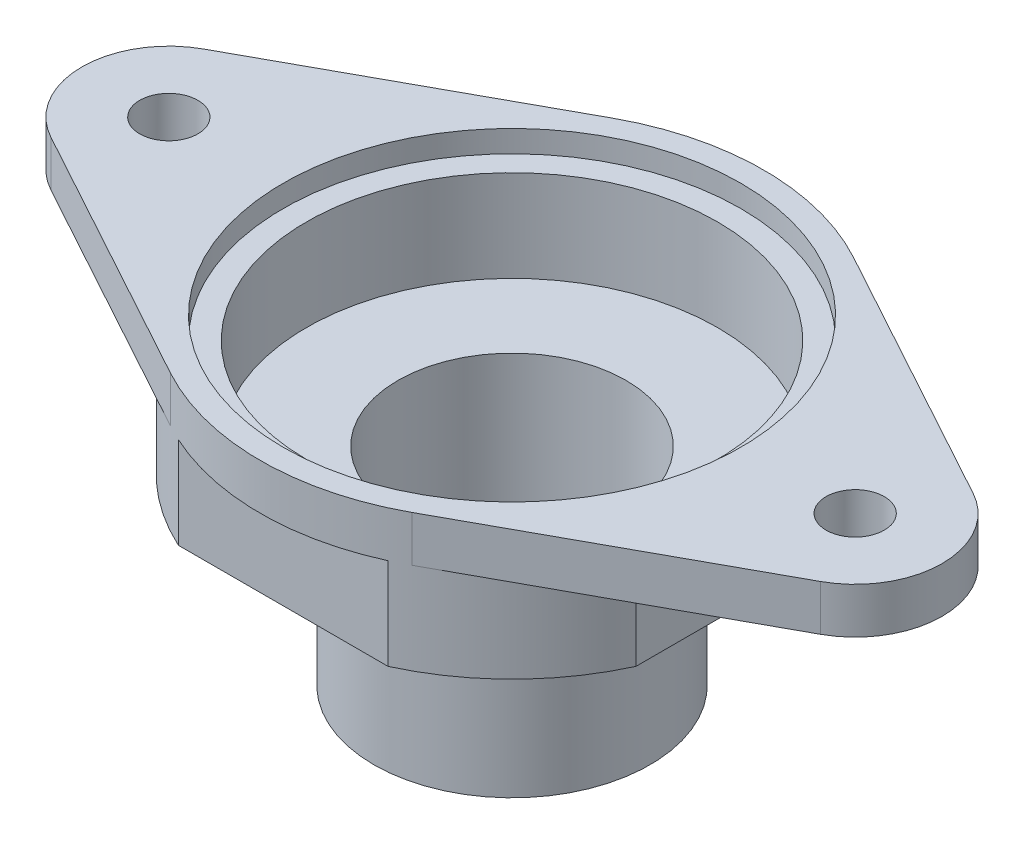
SolidWorks part; units mm, degrees
ref_plane "Front Plane" through (0, 0, 0) normal (0, 0, 1) x (1, 0, 0)
ref_plane "Top Plane" through (0, 0, 0) normal (0, 1, 0) x (1, 0, 0)
ref_plane "Right Plane" through (0, 0, 0) normal (1, 0, 0) x (0, 0, -1)
sketch "Sketch1" plane through (0, 0, 0) normal (0, 1, 0) x (1, 0, 0)
  line L1 (0, 0) -> (63.5, 0)
  line L2 (0, 0) -> (0, 50.8)
  line L3 (0, 50.8) -> (63.5, 50.8)
  line L4 (63.5, 0) -> (63.5, 50.8)
  dimension "D1" = 63.5
  dimension "D2" = 50.8
extrude "Boss-Extrude1" add sketch "Sketch1" along normal blind 22.225
sketch "Sketch2" plane through (0, 22.225, 0) normal (0, 1, 0) x (1, 0, 0)
  line L0 (31.75, 50.8) -> (31.75, 0) construction
  line L1 (63.5, 50.8) -> (0, 50.8) construction
  line L2 (0, 0) -> (63.5, 0) construction
  circle A0 centre (31.75, 25.4) radius 14.2684
  dimension "D1" = 28.5369
extrude "Cut-Extrude1" cut sketch "Sketch2" against normal blind 7.874
sketch "Sketch5" plane through (0, 22.225, 0) normal (0, 1, 0) x (1, 0, 0)
  circle A0 centre (31.75, 25.4) radius 15.875
  dimension "D1" = 31.75
extrude "Cut-Extrude3" cut sketch "Sketch5" against normal blind 1.524
hole_wizard "#10-32 Tapped Hole1" positions "Sketch8" profile "Sketch7" tap size "#10-32" standard "ANSI Inch"
sketch "Sketch8" plane through (0, 22.225, 0) normal (0, 1, 0) x (1, 0, 0)
  line L0 (31.75, 41.275) -> (31.75, 9.525) construction
  circle A0 centre (31.75, 25.4) radius 15.875 construction
  circle A1 centre (31.75, 25.4) radius 15.875 construction
  point P0 (7.9375, 25.4)
  point P3 (55.5625, 25.4)
  dimension "D1" = 47.625
sketch "Sketch7" plane through (7.9375, 22.225, -25.4) normal (1, 0, 0) x (0, 0, 1)
  line L0 (0, 0) -> (0, 22.225)
  line L1 (0, 22.225) -> (2.0193, 22.225)
  line L2 (2.0193, 22.225) -> (2.0193, 0)
  line L5 (2.0193, 0) -> (0, 0)
  line L11 (0, -6.35) -> (0, 107.95) construction
  dimension "Thru Tap Drill Dia." = 4.0386
  dimension "Thru Tap Drill Depth" = 22.225
sketch "Sketch10" plane through (0, 22.225, 0) normal (0, 1, 0) x (1, 0, 0)
  line L0 (31.75, 62.1442) -> (31.75, -6.4766) construction
  line L1 (5.0419, 30.6921) -> (23.368, 40.7193)
  line L2 (40.132, 40.7193) -> (58.4581, 30.6921)
  line L3 (58.4581, 20.1079) -> (40.132, 10.0807)
  line L4 (5.0419, 20.1079) -> (23.368, 10.0807)
  arc A0 (40.132, 40.7193) -> (23.368, 40.7193) centre (31.75, 25.4) ccw
  arc A1 (5.0419, 30.6921) -> (5.0419, 20.1079) centre (7.9375, 25.4) ccw
  arc A2 (58.4581, 20.1079) -> (58.4581, 30.6921) centre (55.5625, 25.4) ccw
  arc A3 (23.368, 10.0807) -> (40.132, 10.0807) centre (31.75, 25.4) ccw
  dimension "D1" = 34.925
  dimension "D2" = 12.065
  dimension "D3" = 47.625
extrude "Cut-Extrude5" cut sketch "Sketch10" against normal blind 25.4 flip side to cut
sketch "Sketch11" plane through (0, 0, 0) normal (0, -1, 0) x (-1, 0, 0)
  line L0 (-1.905, 25.4) -> (-61.595, 25.4) construction
  line L1 (-15.875, 9.525) -> (-47.625, 9.525)
  line L2 (-15.875, 9.525) -> (-15.875, 41.275)
  line L3 (-15.875, 41.275) -> (-47.625, 41.275)
  line L4 (-47.625, 9.525) -> (-47.625, 41.275)
  line L5 (-31.75, 7.9375) -> (-31.75, 42.8625) construction
  arc A4 (-5.0419, 20.1079) -> (-5.0419, 30.6921) centre (-7.9375, 25.4) ccw construction
  arc A5 (-58.4581, 30.6921) -> (-58.4581, 20.1079) centre (-55.5625, 25.4) ccw construction
  dimension "D1" = 31.75
  dimension "D2" = 31.75
extrude "Cut-Extrude7" cut sketch "Sketch11" against normal blind 19.05 flip side to cut
sketch "Sketch12" plane through (0, 14.351, 0) normal (0, 1, 0) x (1, 0, 0)
  circle A0 centre (31.75, 25.4) radius 7.9184
  circle A1 centre (31.75, 25.4) radius 14.2684 construction
  dimension "D1" = 6.35
extrude "Cut-Extrude8" cut sketch "Sketch12" against normal through all
sketch "Sketch13" plane through (0, 0, 0) normal (0, -1, 0) x (-1, 0, 0)
  circle A0 centre (-31.75, 25.4) radius 9.5821
  dimension "D1" = 19.1643
extrude "Cut-Extrude9" cut sketch "Sketch13" against normal blind 12.7 flip side to cut
sketch "Sketch14" plane through (0, 12.7, 0) normal (0, -1, 0) x (-1, 0, 0)
  circle A0 centre (-31.75, 25.4) radius 17.4625
  arc A1 (-39.0248, 9.525) -> (-24.4752, 9.525) centre (-31.75, 25.4) ccw construction
extrude "Cut-Extrude10" cut sketch "Sketch14" against normal up to surface (6.35 mm away) flip side to cut
